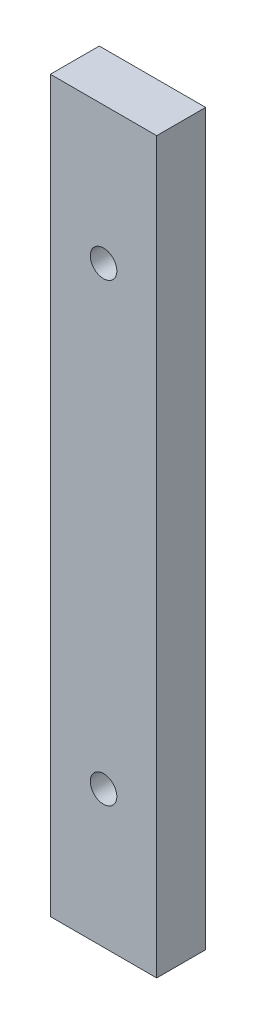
SolidWorks part; units mm, degrees
ref_plane "Přední rovina" through (0, 0, 0) normal (0, 0, 1) x (1, 0, 0)
ref_plane "Horní rovina" through (0, 0, 0) normal (0, 1, 0) x (1, 0, 0)
ref_plane "Pravá rovina" through (0, 0, 0) normal (1, 0, 0) x (0, 0, -1)
sketch "Skica1" plane through (0, 0, 0) normal (0, 0, 1) x (1, 0, 0)
  line L0 (-17.7964, 18.4225) -> (-17.7964, -50.1775) construction
  line L1 (-22.7964, 18.4225) -> (-12.7964, 18.4225)
  line L2 (-22.7964, 18.4225) -> (-22.7964, -50.1775)
  line L3 (-22.7964, -50.1775) -> (-12.7964, -50.1775)
  line L4 (-12.7964, 18.4225) -> (-12.7964, -50.1775)
  circle A0 centre (-17.7964, 5.5225) radius 0.5
  circle A1 centre (-17.7964, -37.2775) radius 0.5
  point P6 (-17.7964, 5.5225)
  point P7 (-17.7964, -37.2775)
  point P8 (-17.7964, -15.8775)
  dimension "D6" = 1
  dimension "D7" = 1
  dimension "D1" = 10
  dimension "D2" = 68.6
  dimension "D3" = 42.8
  dimension "D4" = 12.9
  dimension "D5" = 12.9
extrude "Přidat vysunutím1" add sketch "Skica1" along normal blind 4.6
hole_wizard "M3 závit4" positions "Skica8" profile "Skica7" tap size "M3" standard "ISO"
sketch "Skica8" plane through (0, 0, 4.6) normal (0, 0, 1) x (1, 0, 0)
  point P0 (-17.7964, 5.5225)
  point P3 (-17.7964, -37.2775)
sketch "Skica7" plane through (-17.7964, 5.5225, 4.6) normal (1, 0, 0) x (0, -1, 0)
  line L0 (0, 0) -> (0, 4.6)
  line L1 (0, 4.6) -> (1.25, 4.6)
  line L2 (1.25, 4.6) -> (1.25, 0)
  line L5 (1.25, 0) -> (0, 0)
  line L11 (0, -6.35) -> (0, 107.95) construction
  dimension "Průměr závitníku" = 2.5
  dimension "Hloubka závitníku" = 4.6
